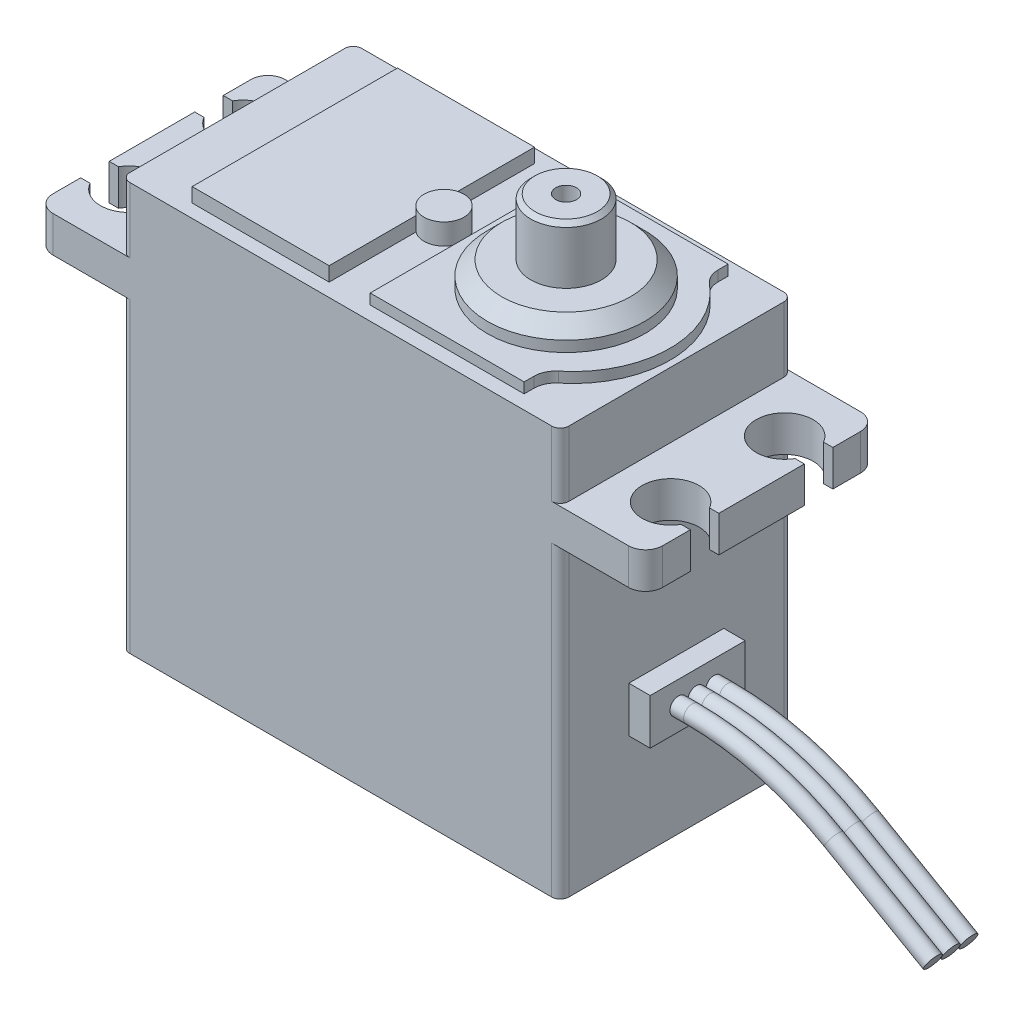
SolidWorks part; units mm, degrees
ref_plane "Front Plane" through (0, 0, 0) normal (0, 0, 1) x (1, 0, 0)
ref_plane "Top Plane" through (0, 0, 0) normal (0, 1, 0) x (1, 0, 0)
ref_plane "Right Plane" through (0, 0, 0) normal (1, 0, 0) x (0, 0, -1)
sketch "Sketch1" plane through (0, 0, 0) normal (0, 1, 0) x (1, 0, 0)
  line L1 (0, 0) -> (30.8, 0)
  line L2 (0, 0) -> (0, 16.28)
  line L3 (0, 16.28) -> (30.8, 16.28)
  line L4 (30.8, 0) -> (30.8, 16.28)
  dimension "D1" = 16.28
  dimension "D2" = 30.8
extrude "Boss-Extrude1" add sketch "Sketch1" along normal blind 28.62
sketch "Sketch3" plane through (0, 0, 0) normal (0, 0, 1) x (1, 0, 0)
  line L0 (0, 21.51) -> (30.8, 21.51) construction
  line L1 (0, 28.62) -> (0, 0) construction
  line L2 (30.8, 28.62) -> (30.8, 0) construction
  line L3 (0, 0) -> (30.8, 0) construction
  line L4 (15.4, 28.62) -> (15.4, 24.7543) construction
  line L5 (30.8, 21.51) -> (36.785, 21.51)
  line L6 (30.8, 21.51) -> (30.8, 24.04)
  line L7 (30.8, 24.04) -> (36.785, 24.04)
  line L8 (36.785, 21.51) -> (36.785, 24.04)
  line L9 (0, 28.62) -> (30.8, 28.62) construction
  line L10 (-5.985, 21.51) -> (-5.985, 24.04)
  line L11 (0, 24.04) -> (-5.985, 24.04)
  line L12 (0, 21.51) -> (0, 24.04)
  line L13 (0, 21.51) -> (-5.985, 21.51)
  dimension "D1" = 21.51
  dimension "D2" = 2.53
  dimension "D3" = 21.385
extrude "Boss-Extrude2" add sketch "Sketch3" against normal up to surface (16.28 mm away)
sketch "Sketch4" plane through (0, 28.62, 0) normal (0, 1, 0) x (1, 0, 0)
  line L0 (4.04, 8.14) -> (0, 8.14) construction
  line L1 (13.65, 15.345) -> (4.04, 15.345)
  line L2 (13.65, 15.345) -> (13.65, 0.935)
  line L3 (13.65, 0.935) -> (4.04, 0.935)
  line L4 (4.04, 15.345) -> (4.04, 0.935)
  line L5 (0, 16.28) -> (0, 0) construction
  line L6 (30.8, 0) -> (30.8, 16.28) construction
  dimension "D1" = 14.41
  dimension "D2" = 9.61
  dimension "D3" = 26.76
extrude "Boss-Extrude3" add sketch "Sketch4" along normal blind 1
sketch "Sketch5" plane through (0, 28.62, 0) normal (0, 1, 0) x (1, 0, 0)
  line L0 (13.65, 0.935) -> (13.65, 15.345) construction
  line L1 (27.28, 0.985) -> (16.48, 0.985)
  line L2 (27.28, 2.4415) -> (27.28, 13.8385) construction
  line L3 (27.28, 15.295) -> (16.48, 15.295)
  line L4 (16.48, 0.985) -> (16.48, 15.295)
  line L5 (30.36, 8.14) -> (30.8, 8.14) construction
  line L6 (30.8, 0) -> (30.8, 16.28) construction
  line L7 (23.23, 8.14) -> (28.73, 8.14) construction
  line L8 (27.28, 0.985) -> (27.28, 2.4415)
  line L9 (4.04, 15.345) -> (4.04, 0.935) construction
  line L11 (27.28, 13.8385) -> (27.28, 15.295)
  arc A1 (27.28, 2.4415) -> (27.28, 13.8385) centre (23.5484, 8.14) ccw
  dimension "D1" = 2.83
  dimension "D2" = 1.4565
  dimension "D3" = 10.8
  dimension "D5" = 13.88
  dimension "D6" = 24.69
extrude "Boss-Extrude4" add sketch "Sketch5" along normal blind 0.73
sketch "Sketch6" plane through (0, 29.35, 0) normal (0, 1, 0) x (1, 0, 0)
  line L0 (28.59, 8.14) -> (23.07, 8.14) construction
  line L1 (4.04, 15.345) -> (4.04, 0.935) construction
  circle A0 centre (23.07, 8.14) radius 5.52
  dimension "D1" = 11.04
  dimension "D2" = 24.55
extrude "Boss-Extrude5" add sketch "Sketch6" along normal blind 1.75
chamfer "Chamfer1" distance 1 angle 45 1 edges at (23.07, 31.1, -2.62)
fillet "Fillet1" radius 1.5 2 edges at (27.28, 28.985, -13.8385) (27.28, 28.985, -2.4415)
sketch "Sketch7" plane through (0, 28.62, 0) normal (0, 1, 0) x (1, 0, 0)
  circle A0 centre (14.5043, 8.14) radius 1.4
  dimension "D1" = 2.8
extrude "Boss-Extrude6" add sketch "Sketch7" along normal blind 1.47
sketch "Sketch8" plane through (0, 31.1, 0) normal (0, 1, 0) x (1, 0, 0)
  circle A0 centre (23.07, 8.14) radius 2.48
  dimension "D1" = 4.96
extrude "Boss-Extrude7" add sketch "Sketch8" along normal blind 4
sketch "Sketch9" plane through (0, 24.04, 0) normal (0, 1, 0) x (1, 0, 0)
  line L0 (30.8, 8.14) -> (36.785, 8.14) construction
  line L1 (30.8, 16.28) -> (30.8, 0) construction
  line L2 (36.785, 16.28) -> (36.785, 0) construction
  line L3 (15.4, 16.28) -> (15.4, 0) construction
  line L4 (30.8, 16.28) -> (0, 16.28) construction
  line L5 (0, 0) -> (30.8, 0) construction
  line L6 (34.4, 12.14) -> (32.4, 12.14) construction
  line L7 (34.4, 10.14) -> (34.4, 8.14) construction
  line L8 (37.2465, 13.14) -> (37.2465, 11.14)
  line L9 (36.1321, 11.14) -> (37.2465, 11.14)
  line L10 (36.1321, 3.14) -> (37.2465, 3.14)
  line L11 (36.1321, 13.14) -> (37.2465, 13.14)
  line L12 (37.2465, 3.14) -> (37.2465, 5.14)
  line L13 (36.1321, 5.14) -> (37.2465, 5.14)
  line L14 (-3.6, 10.14) -> (-3.6, 8.14) construction
  line L15 (-3.6, 12.14) -> (-1.6, 12.14) construction
  line L16 (0, 8.14) -> (-5.985, 8.14) construction
  line L17 (-5.3321, 5.14) -> (-6.4465, 5.14)
  line L18 (-6.4465, 3.14) -> (-6.4465, 5.14)
  line L19 (-5.3321, 13.14) -> (-6.4465, 13.14)
  line L20 (-5.3321, 3.14) -> (-6.4465, 3.14)
  line L21 (-5.3321, 11.14) -> (-6.4465, 11.14)
  line L22 (-6.4465, 13.14) -> (-6.4465, 11.14)
  arc A0 (36.1321, 13.14) -> (36.1321, 11.14) centre (34.4, 12.14) ccw
  arc A1 (36.1321, 3.14) -> (36.1321, 5.14) centre (34.4, 4.14) cw
  arc A2 (-5.3321, 3.14) -> (-5.3321, 5.14) centre (-3.6, 4.14) ccw
  arc A3 (-5.3321, 13.14) -> (-5.3321, 11.14) centre (-3.6, 12.14) cw
  point P17 (36.4, 12.14)
  point P41 (-5.6, 12.14)
  dimension "D1" = 4
  dimension "D2" = 17
  dimension "D3" = 2
  dimension "D4" = 2
extrude "Cut-Extrude1" cut sketch "Sketch9" against normal blind 4
sketch "Sketch10" plane through (30.8, 0, 0) normal (1, 0, 0) x (0, 0, -1)
  line L0 (8.14, 7.69) -> (8.14, 0) construction
  line L1 (4.81, 7.69) -> (11.47, 7.69)
  line L2 (4.81, 7.69) -> (4.81, 10.89)
  line L3 (4.81, 10.89) -> (11.47, 10.89)
  line L4 (11.47, 7.69) -> (11.47, 10.89)
  line L5 (4.81, 7.69) -> (11.47, 10.89) construction
  line L6 (4.81, 10.89) -> (11.47, 7.69) construction
  line L7 (0, 0) -> (16.28, 0) construction
  point P0 (8.14, 9.29)
  dimension "D1" = 6.66
  dimension "D2" = 3.2
  dimension "D3" = 7.69
extrude "Boss-Extrude8" add sketch "Sketch10" along normal blind 1.5
sketch "Sketch11" plane through (32.3, 0, 0) normal (1, 0, 0) x (0, 0, -1)
  circle A0 centre (6.794, 9.2745) radius 0.6
  circle A1 centre (8.0453, 9.2745) radius 0.6
  circle A2 centre (9.29, 9.2745) radius 0.6
  dimension "D1" = 1.2
ref_plane "Plane1" through (0, 0, -8.14) normal (0, 0, -1) x (-1, 0, 0)
sketch "Sketch12" plane through (0, 0, -8.14) normal (0, 0, -1) x (-1, 0, 0)
  line L0 (-32.3, 9.2745) -> (-33.2613, 9.2745)
  line L1 (-32.3, 9.8745) -> (-32.3, 8.6745) construction
  line L2 (-43.2074, 6.626) -> (-50.1464, 2.6485)
  arc A1 (-33.2613, 9.2745) -> (-43.2074, 6.626) centre (-33.2613, -10.7255) ccw
sweep "Sweep1" add profiles "Sketch11" path "Sketch12"
fillet "Fillet2" radius 1.2 4 edges at (-5.985, 22.775, 0) (-5.985, 22.775, -16.28) (36.785, 22.775, 0) (36.785, 22.775, -16.28)
fillet "Fillet3" radius 0.6 8 edges
chamfer "Chamfer2" distance 0.3 angle 45 1 edges at (23.07, 35.1, -5.66)
sketch "Sketch13" plane through (0, 35.1, 0) normal (0, 1, 0) x (1, 0, 0)
  circle A0 centre (23.07, 8.14) radius 0.7264
extrude "Cut-Extrude2" cut sketch "Sketch13" against normal blind 2.5
sketch "Sketch14" plane through (0, 0, -16.28) normal (0, 0, -1) x (-1, 0, 0)
  text T0 "Daniel Angeles" font "Lemon/Milk" height in points 8
